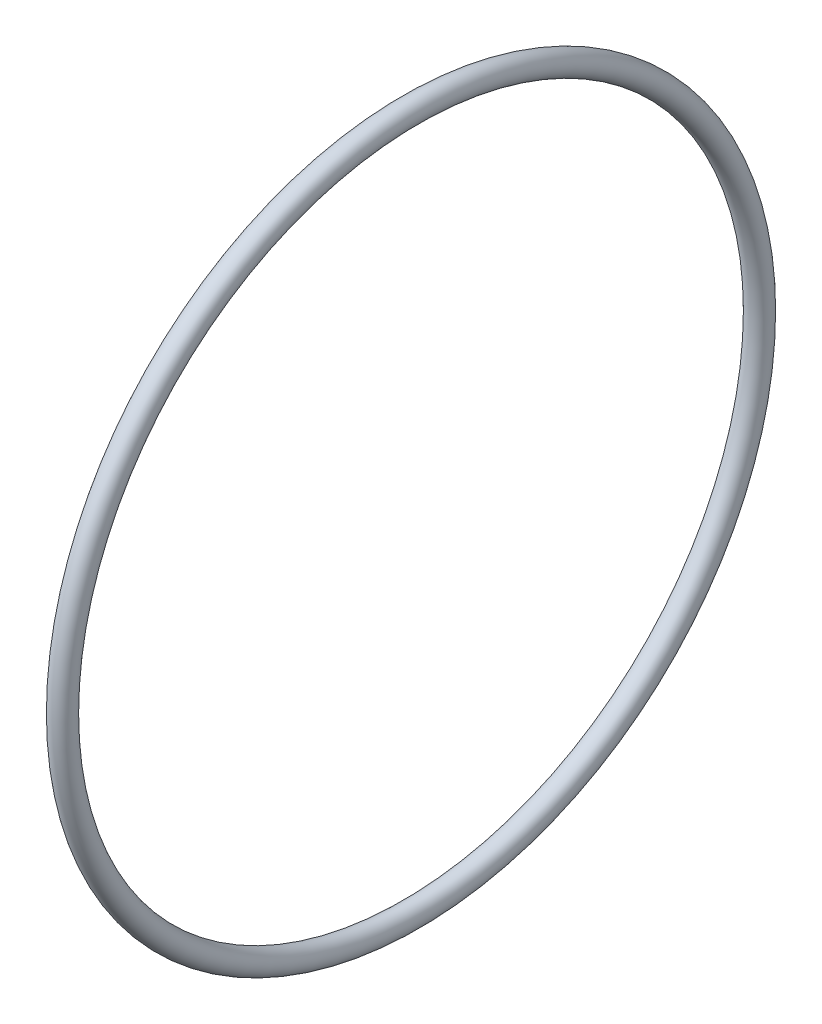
SolidWorks part; units mm, degrees
ref_plane "Front" through (0, 0, 0) normal (0, 0, 1) x (1, 0, 0)
ref_plane "Top" through (0, 0, 0) normal (0, 1, 0) x (1, 0, 0)
ref_plane "Right" through (0, 0, 0) normal (1, 0, 0) x (0, 0, -1)
sketch "Sketch1" plane through (0, 0, 0) normal (0, 0, 1) x (1, 0, 0)
  line L0 (0, 0) -> (-7.4041, 0) construction
  line L1 (0, 53.9496) -> (-1.7653, 53.9496) construction
  circle A0 centre (0, 53.9496) radius 1.7653
  dimension "D1" = 3.5306
  dimension "D2" = 52.1843
revolve "Revolve1" add sketch "Sketch1" angle 360 about L0
